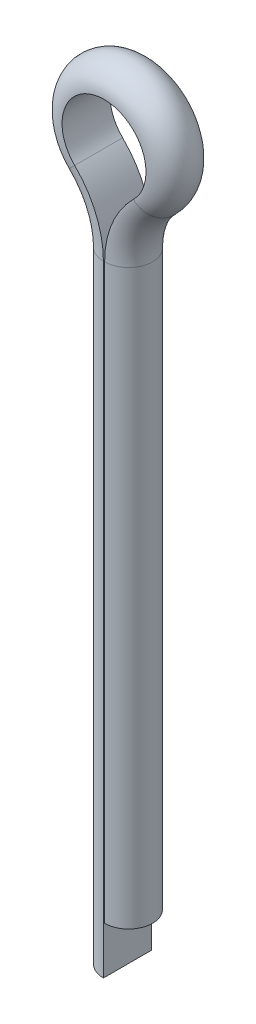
SolidWorks part; units mm, degrees
ref_plane "Plane1" through (0, 0, 0) normal (0, 0, 1) x (1, 0, 0)
ref_plane "Plane2" through (0, 0, 0) normal (0, 1, 0) x (1, 0, 0)
ref_plane "Plane3" through (0, 0, 0) normal (1, 0, 0) x (0, 0, -1)
sketch "Sketch1" plane through (0, 0, 0) normal (0, 0, 1) x (1, 0, 0)
  line L0 (0.025, -4.1063) -> (0.025, -28)
  line L1 (-0.025, -4.1063) -> (-0.025, -30)
  arc A0 (-1.225, -1.2497) -> (1.225, -1.2497) centre (0, 0) cw
  arc A1 (-0.025, -4.1063) -> (-1.225, -1.2497) centre (-4.025, -4.1063) ccw
  arc A2 (0.025, -4.1063) -> (1.225, -1.2497) centre (4.025, -4.1063) cw
  point P8 (-0.025, -1.7498)
  point P11 (0.025, -1.7498)
  dimension "D2" = 1.75
  dimension "D4" = 4
  dimension "D5" = 2
  dimension "D1" = 0.05
  dimension "D3" = 30
ref_plane "Plane4" through (0.025, -28, 0) normal (0, -1, 0) x (1, 0, 0)
sketch "Sketch2" plane through (0.025, -28, 0) normal (0, -1, 0) x (1, 0, 0)
  line L0 (0, 1) -> (0, -1)
  arc A0 (0, 1) -> (0, -1) centre (0, 0) cw
  dimension "D1" = 2
sweep "Pin" add profiles "Sketch2" path "Sketch1"
